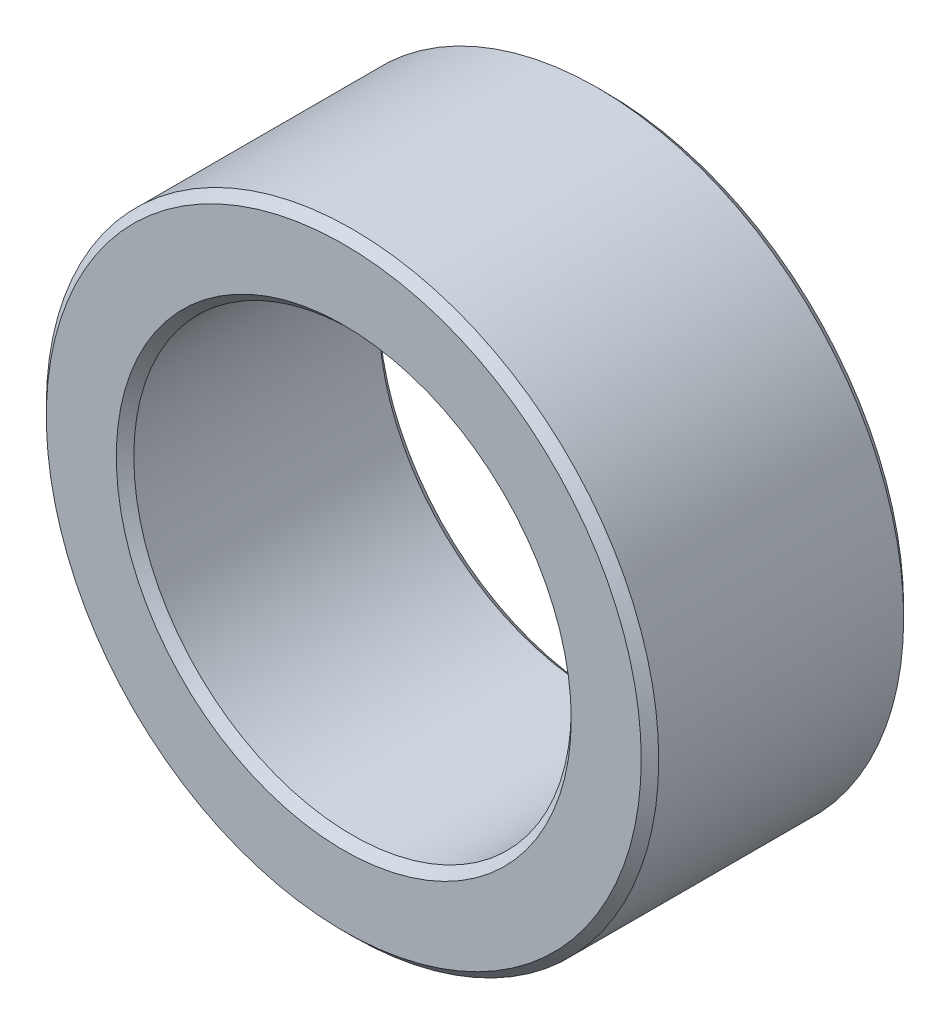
SolidWorks part; units mm, degrees
ref_plane "Plan 1" through (0, 0, 0) normal (0, 0, 1) x (1, 0, 0)
ref_plane "Plan 2" through (0, 0, 0) normal (0, 1, 0) x (1, 0, 0)
ref_plane "Plan 3" through (0, 0, 0) normal (1, 0, 0) x (0, 0, -1)
sketch "Esquisse1" plane through (0, 0, 0) normal (0, 0, 1) x (1, 0, 0)
  circle A0 centre (0, 0) radius 12.5
  circle A1 centre (0, 0) radius 17.5
  dimension "D1" = 25
  dimension "D2" = 35
extrude "Extrusion1" add sketch "Esquisse1" along normal blind 15
chamfer "Chanfrein1" distance 0.5 angle 45 4 edges at (12.5, 0, 0) (17.5, 0, 0) (17.5, 0, 15) (12.5, 0, 15)
